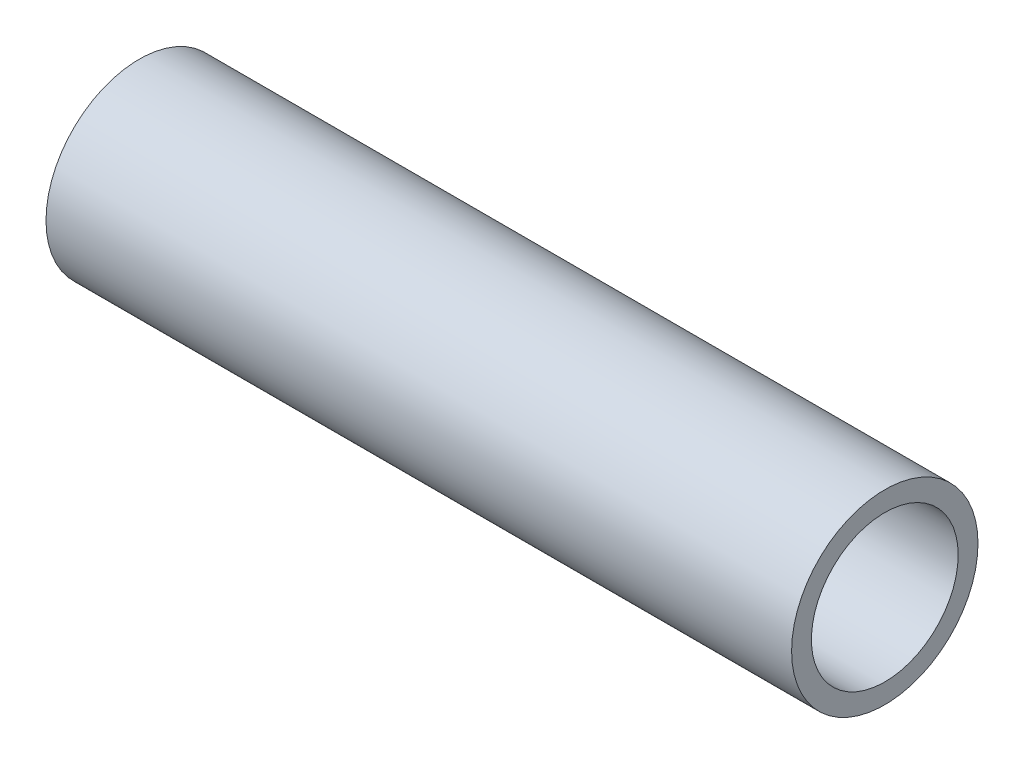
SolidWorks part; units mm, degrees
ref_plane "Front" through (0, 0, 0) normal (0, 0, 1) x (1, 0, 0)
ref_plane "Top" through (0, 0, 0) normal (0, 1, 0) x (1, 0, 0)
ref_plane "Right" through (0, 0, 0) normal (1, 0, 0) x (0, 0, -1)
sketch "Sketch1" plane through (0, 0, 0) normal (1, 0, 0) x (0, 0, -1)
  circle A0 centre (0, 0) radius 6.35
  circle A1 centre (0, 0) radius 5
  dimension "D1" = 10
  dimension "D2" = 12.7
extrude "Extrude1" add sketch "Sketch1" along normal mid plane 50.8
